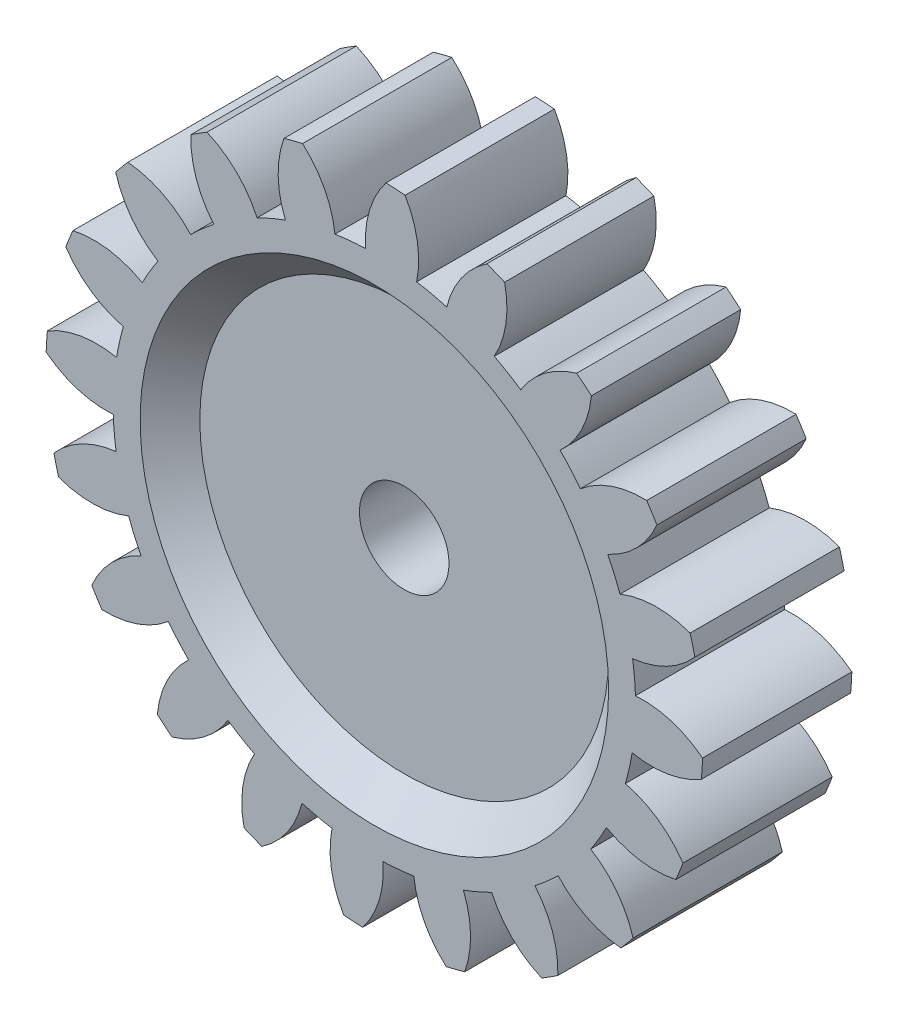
SolidWorks part; units mm, degrees
ref_plane "Front Plane" through (0, 0, 0) normal (0, 0, 1) x (1, 0, 0)
ref_plane "Top Plane" through (0, 0, 0) normal (0, 1, 0) x (1, 0, 0)
ref_plane "Right Plane" through (0, 0, 0) normal (1, 0, 0) x (0, 0, -1)
sketch "Root Circle" plane through (0, 0, 0) normal (0, 0, 1) x (1, 0, 0)
  circle A0 centre (0, 0) radius 8.75
extrude "Root Circle Thickness" add sketch "Root Circle" along normal blind 5
sketch "Sketch3" plane through (0, 0, 5) normal (0, 0, 1) x (1, 0, 0)
  line L0 (0, 0) -> (8.75, 0) construction
  line L1 (8.75, 0) -> (10.8889, 0) construction
  line L2 (0, 0) -> (8.8302, 3.2139) construction
  line L3 (8.8302, 3.2139) -> (10, 0) construction
  line L4 (10.3545, 0) -> (8.5279, -3.9468) construction
  line L5 (9.999, 0.1399) -> (9.9792, -0.6453) construction
  line L6 (0, 0) -> (9.9792, -0.6453) construction
  circle A0 centre (0, 0) radius 9.3969 construction
  circle A1 centre (0, 0) radius 10 construction
  arc A2 (10.9518, -1.0289) -> (10.9931, -0.3901) centre (0, 0) ccw
  circle A3 centre (0, 0) radius 8.75 construction
  arc A4 (10.9931, -0.3901) -> (8.7451, 0.2929) centre (8.9845, -2.9601) ccw
  arc A5 (8.6346, -1.4166) -> (8.7451, 0.2929) centre (0, 0) ccw
  arc A6 (10.9518, -1.0289) -> (8.6346, -1.4166) centre (9.2909, 1.7784) cw
  point P10 (10.3545, 0)
  point P15 (8.9845, -2.9601)
extrude "Extrude3" add sketch "Sketch3" against normal blind 5
pattern_circular "CirPattern1" count 20 over 360 about axis through (0, 0, 0) along (0, 0, 1) of "Extrude3", "Root Circle Thickness"
sketch "Sketch4" plane through (0, 0, 5) normal (0, 0, 1) x (1, 0, 0)
  circle A2 centre (0, 0) radius 1.5
  dimension "D4" = 3
extrude "Extrude4" cut sketch "Sketch4" against normal through all
sketch "Sketch5" plane through (0, 0, 5) normal (0, 0, 1) x (1, 0, 0)
  circle A0 centre (0, 0) radius 6.8462
extrude "Extrude5" cut sketch "Sketch5" against normal blind 1
ref_plane "Plane1" through (0, 0, 2.5) normal (0, 0, 1) x (1, 0, 0)
mirror "Mirror1" about plane through (0, 0, 2.5) normal (0, 0, 1) of "Extrude5"
chamfer "Chamfer1" distance 1 angle 45 2 edges at (6.8462, 0, 0) (6.8462, 0, 5)
equation "\"m\"=1"
equation "\"t\"=20"
equation "\"phi\"=20 ' Pressure Angle"
equation "\"a\"=\"m\" ' Addendum"
equation "\"d\"=1.25*\"a\" ' Dedendum"
equation "\"PCD\"=\"m\"*\"t\" ' Pitch Circle Diameter"
equation "\"TCD\"=\"PCD\"+(2*\"a\") ' Tip Circle Diameter"
equation "\"BCD\"=\"PCD\"* cos( \"phi\")  ' Base Circle Diameter"
equation "\"RCD\"=\"PCD\"-(2*\"d\") ' Root Circle Diameter"
equation "\"P\"= pi *\"m\" ' Circular Pitch"
equation "\"PA\"=360/\"t\" ' Pitch Angle"
equation "\"CTT\"=(pi*\"m\")/4"
equation "\"FR\"=0.3/\"P\" ' Fillet Radius"
equation "\"PC\"=(\"TCD\"-\"BCD\")/6 ' Point C Distance"
equation "\"DpD\"= \"D1@Sketch3\""
equation "\"D2@Sketch3\" = \"DpD\"/4"
